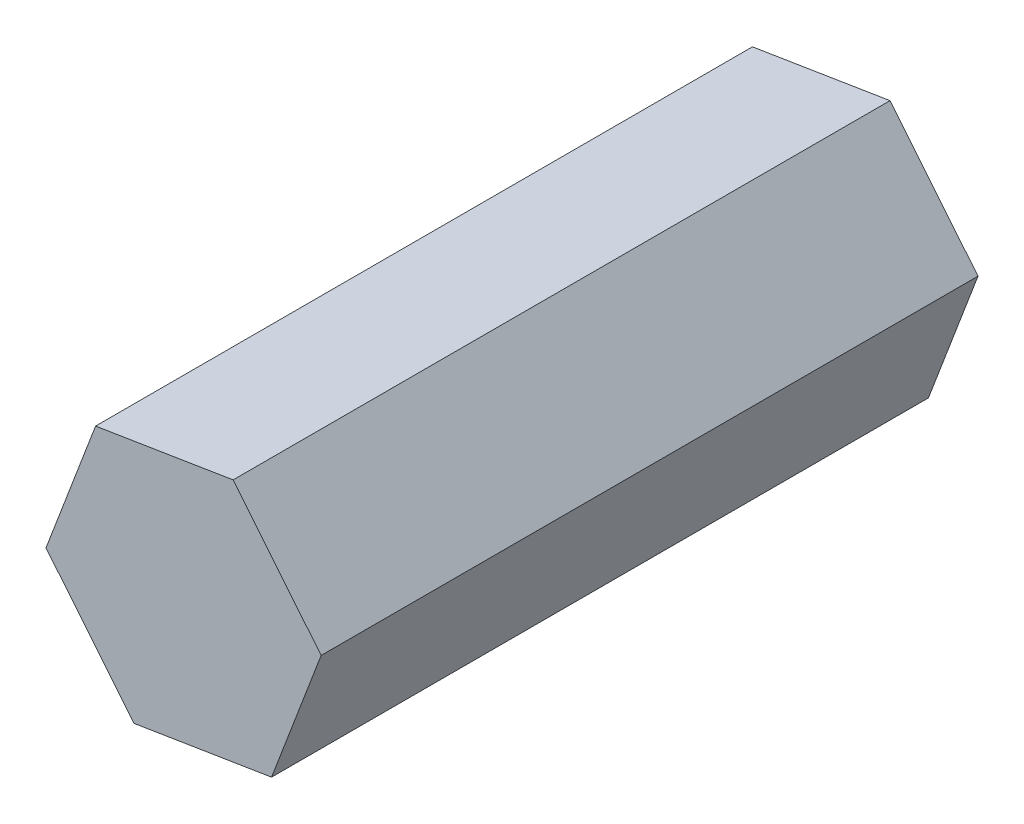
SolidWorks part; units mm, degrees
ref_plane "Ebene vorne" through (0, 0, 0) normal (0, 0, 1) x (1, 0, 0)
ref_plane "Ebene oben" through (0, 0, 0) normal (0, 1, 0) x (1, 0, 0)
ref_plane "Ebene rechts" through (0, 0, 0) normal (1, 0, 0) x (0, 0, -1)
sketch "Sketch1" plane through (0, 0, 0) normal (0, 0, 1) x (1, 0, 0)
  line L1 (18.7532, -23.0276) -> (29.319, 4.7269)
  line L2 (29.319, 4.7269) -> (10.5659, 27.7545)
  line L3 (10.5659, 27.7545) -> (-18.7532, 23.0276)
  line L4 (-18.7532, 23.0276) -> (-29.319, -4.7269)
  line L5 (-29.319, -4.7269) -> (-10.5659, -27.7545)
  line L6 (-10.5659, -27.7545) -> (18.7532, -23.0276)
  circle A0 centre (0, 0) radius 25.7189 construction
extrude "Boss-Extrude1" add sketch "Sketch1" along normal blind 140
